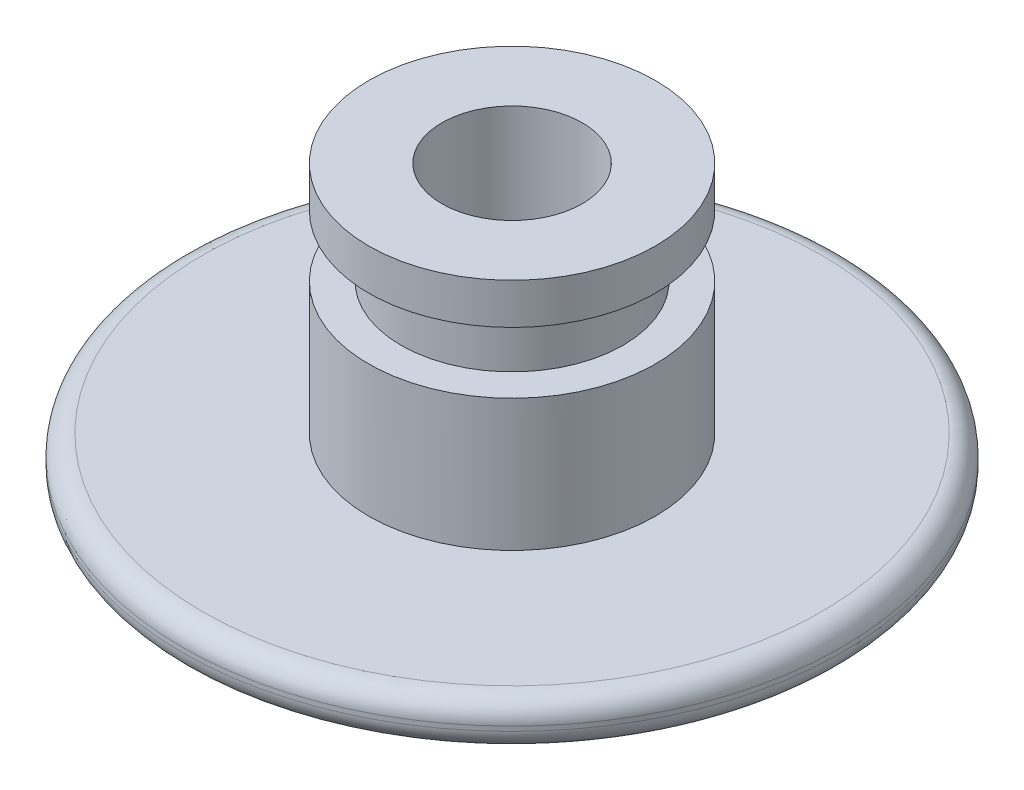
SolidWorks part; units mm, degrees
ref_plane "Front Plane" through (0, 0, 0) normal (0, 0, 1) x (1, 0, 0)
ref_plane "Top Plane" through (0, 0, 0) normal (0, 1, 0) x (1, 0, 0)
ref_plane "Right Plane" through (0, 0, 0) normal (1, 0, 0) x (0, 0, -1)
sketch "Sketch1" plane through (0, 0, 0) normal (0, 1, 0) x (1, 0, 0)
  circle A0 centre (0, 0) radius 12.7
extrude "Extrude1" add sketch "Sketch1" along normal blind 1.7526
sketch "Sketch2" plane through (0, 1.7526, 0) normal (0, 1, 0) x (-1, 0, 0)
  circle A0 centre (0, 0) radius 5.5245
extrude "Extrude2" add sketch "Sketch2" along normal blind 9.017
sketch "Sketch3" plane through (0, 10.7696, 0) normal (0, 1, 0) x (-1, 0, 0)
  circle A0 centre (0, 0) radius 2.7051
extrude "Cut-Extrude1" cut sketch "Sketch3" against normal blind 8.382
sketch "Sketch4" plane through (0, 0, 0) normal (0, -1, 0) x (1, 0, 0)
  circle A0 centre (0, 0) radius 0.8509
extrude "Cut-Extrude2" cut sketch "Sketch4" against normal through all
chamfer "Chamfer2" distance 1.8542 1 edges at (0, 2.3876, 0.8509)
ref_plane "Plane1" through (0, 6.8326, 0) normal (0, -1, 0) x (1, 0, 0)
sketch "Sketch5" plane through (0, 6.8326, 0) normal (0, -1, 0) x (1, 0, 0)
  circle A0 centre (0, 0) radius 4.2799
extrude "Cut-Extrude3" cut sketch "Sketch5" against normal blind 2.3622 flip side to cut
fillet "Fillet1" radius 0.7874 2 edges at (0, 1.7526, 12.7) (0, 0, 12.7)
